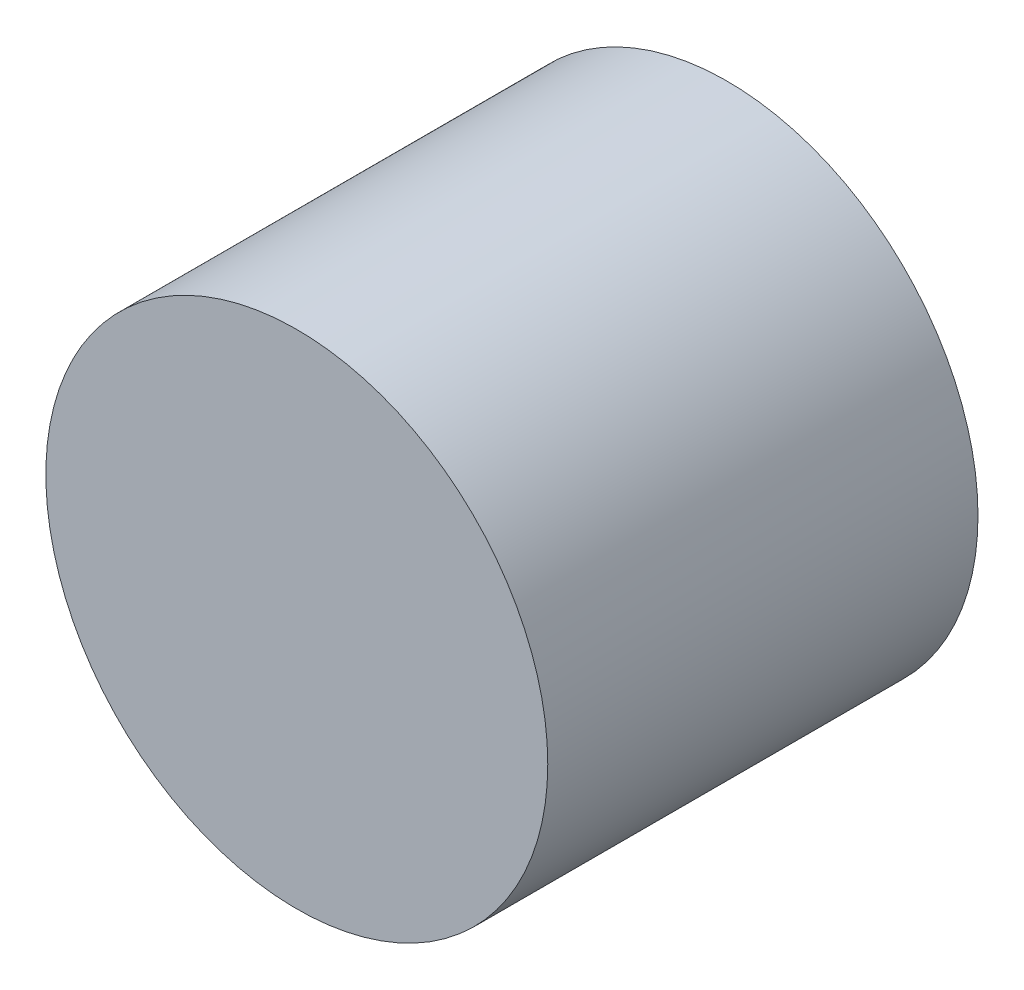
SolidWorks part; units mm, degrees
ref_plane "Front" through (0, 0, 0) normal (0, 0, 1) x (1, 0, 0)
ref_plane "Top" through (0, 0, 0) normal (0, 1, 0) x (1, 0, 0)
ref_plane "Right" through (0, 0, 0) normal (1, 0, 0) x (0, 0, -1)
sketch "Sketch1" plane through (0, 0, 0) normal (0, 0, 1) x (1, 0, 0)
  circle A0 centre (0, 0) radius 17.5
  dimension "D1" = 35
extrude "Boss-Extrude1" add sketch "Sketch1" along normal blind 30
